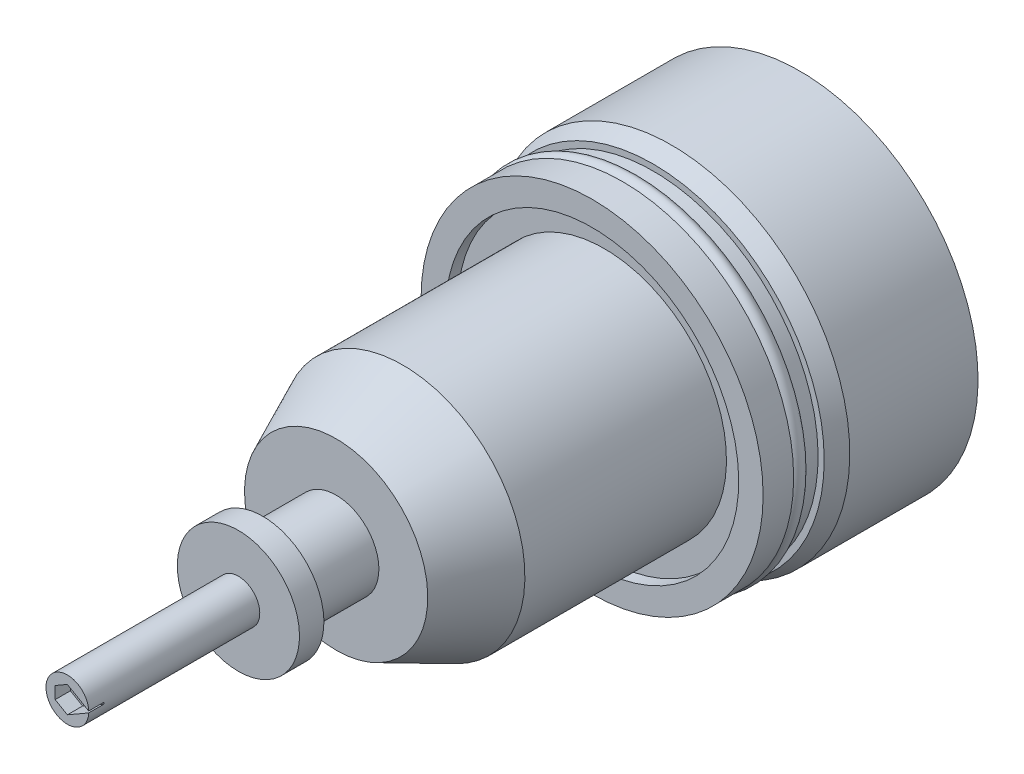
SolidWorks part; units mm, degrees
ref_plane "Front Plane" through (0, 0, 0) normal (0, 0, 1) x (1, 0, 0)
ref_plane "Top Plane" through (0, 0, 0) normal (0, 1, 0) x (1, 0, 0)
ref_plane "Right Plane" through (0, 0, 0) normal (1, 0, 0) x (0, 0, -1)
imported_body "Imported3"
sketch "Sketch1" plane through (0, 0, 157.0968) normal (0, 0, 1) x (1, 0, 0)
  circle A0 centre (0, 0) radius 3.5
extrude "Boss-Extrude1" add sketch "Sketch1" along normal blind 5
sketch "Sketch2" plane through (0, 0, 162.0968) normal (0, 0, 1) x (1, 0, 0)
  line L0 (0, -2.1547) -> (3.4974, -0.1355)
  line L1 (3.4974, 0.1355) -> (0, 2.1547)
  line L2 (0, 2.1547) -> (-2, 1)
  line L3 (-2, 1) -> (-2, -1)
  line L4 (-2, -1) -> (0, -2.1547)
  arc A0 (3.4974, -0.1355) -> (3.4974, 0.1355) centre (0, 0) ccw
extrude "Cut-Extrude1" cut sketch "Sketch2" against normal blind 2.5
sketch "Sketch3" plane through (0, 0, 42.188) normal (0, 0, -1) x (-1, 0, 0)
  circle A0 centre (0, 0) radius 22.1862
extrude "Boss-Extrude2" add sketch "Sketch3" along normal blind 5.8513 draft 46.498
chamfer "Chamfer1" distance 1.1862 angle 68.426 1 edges at (0, -29.1862, 66.188)
chamfer "Chamfer2" distance 5 angle 65.376 1 edges at (0, -20, 118.0968)
sketch "Sketch5" plane through (0, 0, 45.188) normal (0, 0, 1) x (1, 0, 0)
  circle A0 centre (0, 0) radius 29.1862
  circle A2 centre (0, 0) radius 31.6862
extrude "Cut-Extrude4" cut sketch "Sketch5" against normal blind 10
sketch "Sketch8" plane through (0, 0, 134.0968) normal (0, 0, 1) x (1, 0, 0)
  circle A0 centre (0, 0) radius 3.5
  circle A1 centre (0, 0) radius 23.5272
extrude "Cut-Extrude5" cut sketch "Sketch8" along normal through all
